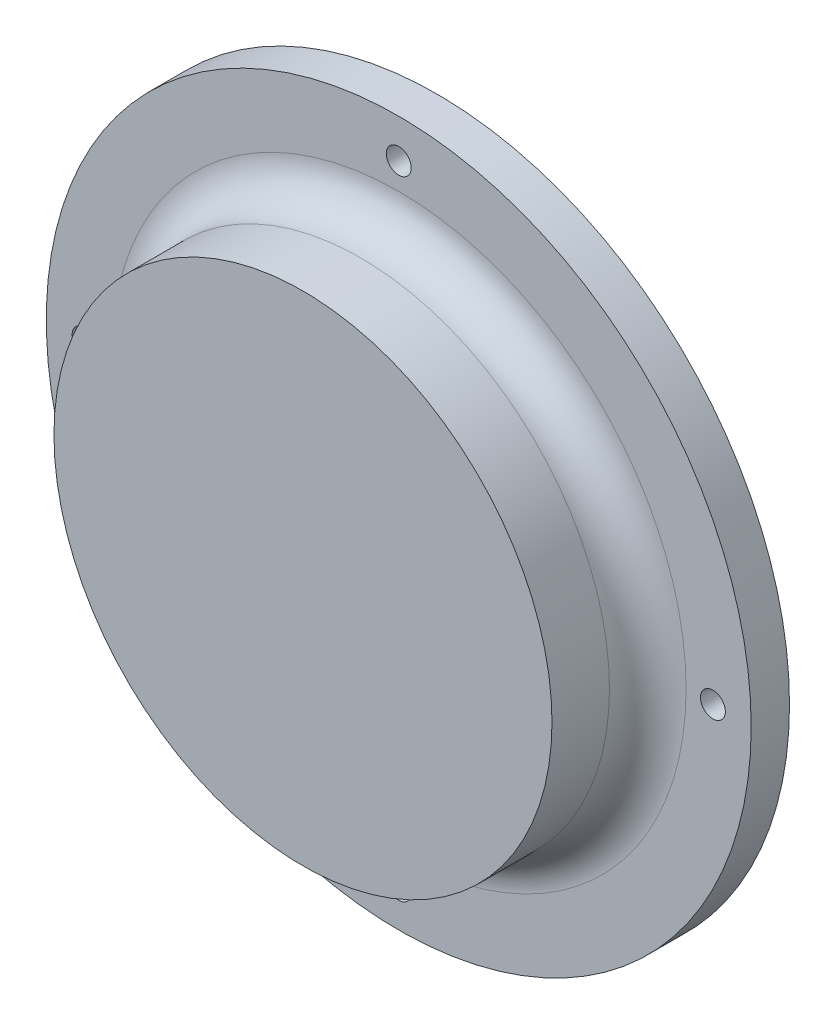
SolidWorks part; units mm, degrees
ref_plane "Face" through (0, 0, 0) normal (0, 0, 1) x (1, 0, 0)
ref_plane "Dessus" through (0, 0, 0) normal (0, 1, 0) x (1, 0, 0)
ref_plane "Droite" through (0, 0, 0) normal (1, 0, 0) x (0, 0, -1)
sketch "Esquisse1" plane through (0, 0, 0) normal (0, 0, 1) x (1, 0, 0)
  circle A1 centre (0, 0) radius 92
  dimension "D1" = 184
extrude "Embase" add sketch "Esquisse1" along normal blind 10
fillet "Arrondi-5mm" radius 5
sketch "Esquisse2" plane through (0, 0, 10) normal (0, 0, 1) x (1, 0, 0)
  circle A0 centre (0, 81.9027) radius 3.25
  circle A1 centre (-82, 0) radius 3.25
  circle A2 centre (0, -82) radius 3.25
  circle A3 centre (82, 0) radius 3.25
  circle A4 centre (0, 0) radius 82 construction
  dimension "D1" = 6.5
  dimension "D2" = 164
extrude "perçages-6,5mm" cut sketch "Esquisse2" against normal through all
sketch "Esquisse3" plane through (0, 0, 10) normal (0, 0, 1) x (1, 0, 0)
  circle A0 centre (0, 0) radius 65
  dimension "D1" = 130
extrude "corps" add sketch "Esquisse3" along normal blind 25
fillet "Congé-10mm" radius 10 1 edges at (65, 0, 10)
sketch "Esquisse4" plane through (0, 0, 0) normal (0, 0, 1) x (1, 0, 0)
  circle A0 centre (0, 0) radius 69
  dimension "D1" = 138
extrude "pénétration cylindrique" add sketch "Esquisse4" against normal blind 7
chamfer "Chanfrein-1.5" distance 1.5 angle 45 1 edges at (69, 0, -7)
